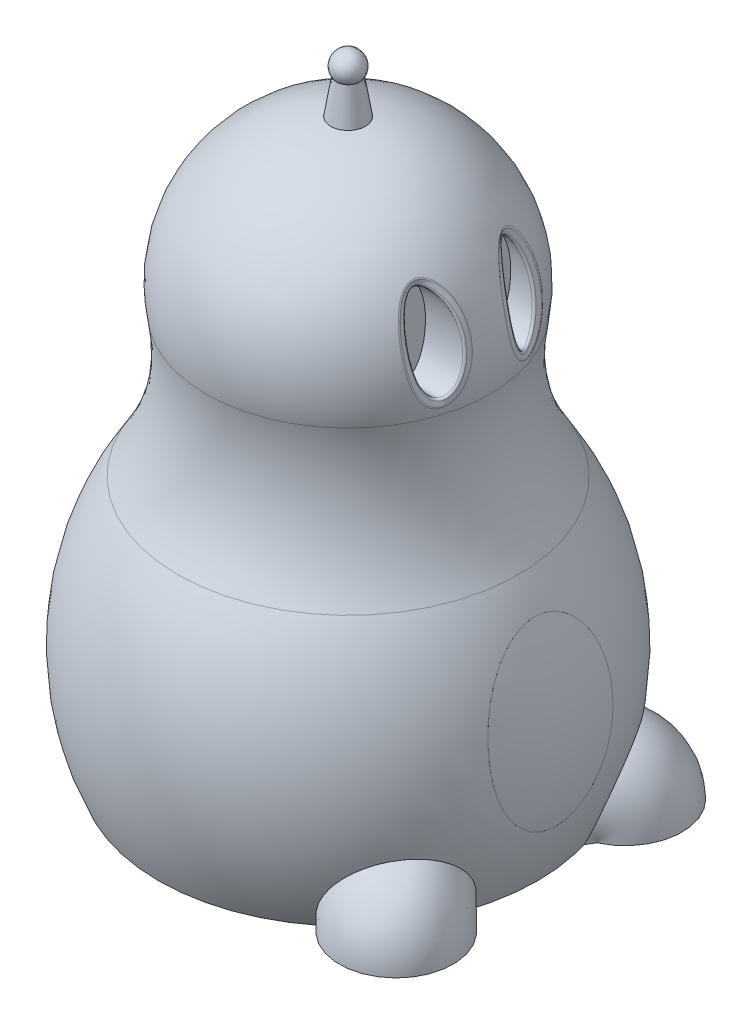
SolidWorks part; units mm, degrees
ref_plane "Front Plane" through (0, 0, 0) normal (0, 0, 1) x (1, 0, 0)
ref_plane "Top Plane" through (0, 0, 0) normal (0, 1, 0) x (1, 0, 0)
ref_plane "Right Plane" through (0, 0, 0) normal (1, 0, 0) x (0, 0, -1)
ref_plane "Plane1" through (27.765, 0, 0) normal (1, 0, 0) x (0, 0, -1)
sketch "Sketch1" plane through (0, 0, 0) normal (1, 0, 0) x (0, 0, -1)
  line L0 (0, 0) -> (0, 60)
  line L1 (20, 0) -> (0, 0)
  line L2 (0, 60) -> (-26.593, 60) construction
  line L3 (18, 27) -> (0, 27) construction
  line L4 (15, 42) -> (0, 42) construction
  line L5 (0, 60) -> (0, 66)
  line L8 (1.2294, 63.6406) -> (1.8233, 59.8906)
  arc A0 (1.8233, 59.8906) -> (15, 42) centre (0, 44.75) cw
  arc A1 (15, 42) -> (18, 27) centre (35.3478, 38.2696) ccw
  arc A2 (18, 27) -> (20, 0) centre (-5.5845, 11.6789) cw
  arc A4 (1.8233, 59.8906) -> (0, 60) centre (0, 44.75) ccw construction
  arc A5 (0, 66) -> (1.2294, 63.6406) centre (0, 64.5) cw
  point P13 (0, 0)
  point P15 (0, 65.9664)
  point P19 (0.5215, 62.9525)
  dimension "D2" = 20
  dimension "D7" = 6
  dimension "D9" = 3.75
  dimension "D8" = 1.5
  dimension "D1" = 60
  dimension "D3" = 27
  dimension "D4" = 15
  dimension "D5" = 18
  dimension "D6" = 15
  dimension "D10" = 9
revolve "Revolve1" add sketch "Sketch1" angle 360 about L0
sketch "Sketch2" plane through (27.765, 0, 0) normal (1, 0, 0) x (0, 0, -1)
  line L0 (0, 0) -> (0, 64.0854) construction
  ellipse E0 centre (4.5, 48) end of major axis (4.5, 43) minor radius 2.5
  point P4 (0, 0)
  point P10 (0, 0)
  dimension "D1" = 10
  dimension "D2" = 5
  dimension "D3" = 4.5
  dimension "D4" = 48
extrude "Cut-Extrude1" cut sketch "Sketch2" against normal blind 17 draft 2
sketch "Sketch4" plane through (0, 0, 0) normal (0, 1, 0) x (1, 0, 0)
  line L0 (11.8092, 14.7712) -> (19.6684, 6.6328)
  line L1 (11.8092, 14.7712) -> (0, 27) construction
  line L2 (0, 0) -> (0, 27) construction
  arc A0 (19.6684, 6.6328) -> (11.8092, 14.7712) centre (17.1775, 12.0913) ccw
  point P4 (0, 26.8958)
  dimension "D1" = 27
  dimension "D3" = 6
  dimension "D2" = 44
  dimension "D4" = 17
  dimension "D5" = 2
revolve "Revolve2" add sketch "Sketch4" angle 180 about L1
mirror "Mirror1" about plane through (0, 0, 0) normal (0, 0, 1) of "Revolve2", "Cut-Extrude1"
chamfer "Chamfer1" distance 1 angle 45 2 edges at (12.3756, 52.4618, 4.4649) (12.3756, 52.4618, -4.4649)
fillet "Fillet2" radius 0.25 4 edges
sketch "Sketch5" plane through (27.765, 0, 0) normal (1, 0, 0) x (0, 0, -1)
  line L0 (0, 0) -> (0, 15) construction
  ellipse E0 centre (0, 15) end of major axis (0, 24) minor radius 6.5
  point P3 (0, 39.3346)
  point P9 (0, 12.7108)
  point P10 (0, 22.9931)
  point P11 (0, 15.9241)
  point P12 (0, 0)
  point P13 (0, 0)
  point P14 (0, 0)
  dimension "D1" = 18
  dimension "D2" = 15
  dimension "D3" = 13
split "Split1" trim tools "Sketch5" bodies to split 103 resulting bodies 105 106
